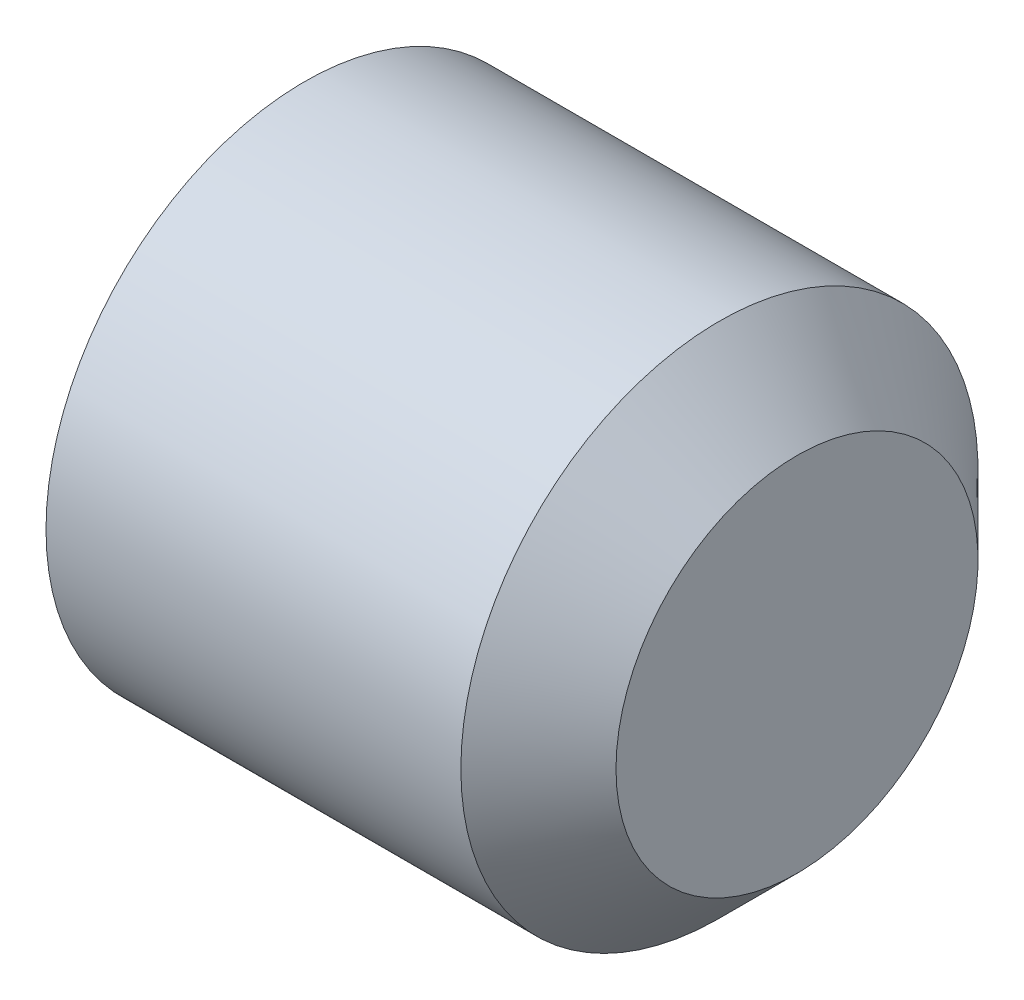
SolidWorks part; units mm, degrees
ref_plane "Plane1" through (0, 0, 0) normal (0, 0, 1) x (1, 0, 0)
ref_plane "Plane2" through (0, 0, 0) normal (0, 1, 0) x (1, 0, 0)
ref_plane "Plane3" through (0, 0, 0) normal (1, 0, 0) x (0, 0, -1)
revolve "BaseBody" add sketch "BodySke" angle 360 about L5
sketch "BodySke" plane through (0, 0, 0) normal (0, 0, 1) x (1, 0, 0)
  line L0 (0, 0) -> (0, 4.172)
  line L1 (0, 4.172) -> (0.478, 5)
  line L2 (0.478, 5) -> (8.5, 5)
  line L3 (8.5, 5) -> (10, 3.5)
  line L4 (10, 0) -> (0, 0)
  line L5 (-12.7, 0) -> (88.9, 0) construction
  line L6 (10, 3.5) -> (10, 0)
  line L7 (10, 3.5) -> (10, 13.025) construction
  line L8 (0, -4.172) -> (0.478, -5) construction
  line L9 (1.5, 15.875) -> (1.5, -3.175) construction
  line L10 (8.5, -5) -> (10, -3.5) construction
  dimension "Length" = 10
  dimension "Diameter" = 10
  dimension "Drive_ch_ang" = 60
  dimension "Minor_dia" = 8.344
  dimension "Cup_nose_ang" = 45
  dimension "Cup_dia" = 7
  dimension "Advance" = 1.5
sketch "Sketch2" plane through (0, 0, 0) normal (-1, 0, 0) x (0, 0, 1)
  line L0 (1.4434, 2.5) -> (-1.4434, 2.5)
  line L1 (-1.4434, 2.5) -> (-2.8868, 0)
  line L2 (1.4434, 2.5) -> (2.8868, 0)
  line L3 (1.4434, -2.5) -> (2.8868, 0)
  line L4 (1.4434, -2.5) -> (-1.4434, -2.5)
  line L5 (-1.4434, -2.5) -> (-2.8868, 0)
  dimension "Hex_size" = 5
  dimension "D2" = 2.5
  dimension "D3" = 2.5
extrude "Hex" cut sketch "Sketch2" against normal blind 5
sketch "Sketch4" plane through (0, 4.7709, -0.5249) normal (-1, 0, 0) x (0, 0, 1)
  line L0 (0.5249, -4.7709) -> (3.3314, -4.7709)
  line L1 (0.5249, -4.7709) -> (6.6732, -1.2211) construction
  line L2 (0.5249, -4.7709) -> (1.9281, -2.3404)
  line L3 (2.8584, -4.1568) -> (3.2099, -3.9539)
  line L4 (2.2234, -3.057) -> (2.5749, -2.8541)
  arc A0 (2.8584, -4.1568) -> (2.2234, -3.057) centre (0.5249, -4.7709) ccw
  arc A1 (3.3314, -4.7709) -> (3.2099, -3.9539) centre (0.5249, -4.7709) ccw
  arc A2 (1.9281, -2.3404) -> (2.5749, -2.8541) centre (0.5249, -4.7709) cw
  circle A3 centre (0.5249, -4.7709) radius 2.413 construction
  circle A4 centre (0.5249, -4.7709) radius 2.8065 construction
  dimension "D1" = 30
  dimension "Spline_n_dim" = 4.826
  dimension "Spline_m_dim" = 5.613
  dimension "Spline_a_dim" = 60
  dimension "D3" = 0.635
  dimension "Spline_p_dim" = 1.27
extrude "Spline6" cut sketch "Sketch4" against normal blind 5
pattern_circular "CirPattern1" count 6 every 60 about axis through (-12.7, 0, 0) along (1, 0, 0)
sketch "Sketch5" plane through (0, 0.6556, 6.6316) normal (-1, 0, 0) x (0, 0, 1)
  line L0 (-6.6316, -0.6556) -> (-3.8251, -0.6556)
  line L1 (-6.6316, -0.6556) -> (-1.6115, 4.3645) construction
  line L2 (-6.6316, -0.6556) -> (-6.6316, 2.1509)
  line L3 (-4.4764, 0.6017) -> (-4.2496, 0.8284)
  line L4 (-5.3744, 1.4997) -> (-5.1476, 1.7265)
  line L5 (-5.3744, 1.4997) -> (-4.4764, 0.6017)
  arc A1 (-3.8251, -0.6556) -> (-4.2496, 0.8284) centre (-6.6316, -0.6556) ccw
  arc A2 (-6.6316, 2.1509) -> (-5.1476, 1.7265) centre (-6.6316, -0.6556) cw
  circle A3 centre (-6.6316, -0.6556) radius 2.413 construction
  circle A4 centre (-6.6316, -0.6556) radius 2.8065 construction
  dimension "D1" = 45
  dimension "Spline_n_dim" = 4.826
  dimension "Spline_m_dim" = 5.613
  dimension "Spline_a_dim" = 90
  dimension "D3" = 0.635
  dimension "Spline_p_dim" = 1.27
extrude "Spline4" cut sketch "Sketch5" against normal blind 5
pattern_circular "CirPattern2" count 4 every 90 about axis through (-12.7, 0, 0) along (1, 0, 0)
sketch "ThdSchSke" plane through (0, 0, 0) normal (0, 0, 1) x (1, 0, 0)
  line L0 (0.478, -4.172) -> (-0.1017, -5)
  line L1 (0.478, -4.172) -> (1.0578, -5)
  line L2 (1.0578, -5) -> (1.0578, -6.25)
  line L3 (-3.175, 0) -> (5.1513, 0) construction
  line L4 (0.478, 5) -> (0.478, -5) construction
  line L5 (1.0578, -6.25) -> (-0.1017, -6.25)
  line L6 (-0.1017, -6.25) -> (-0.1017, -5)
  dimension "Thread_minor" = 8.344
  dimension "Diameter" = 10
  dimension "SideAngle" = 55
  dimension "VeeAngle" = 70
  dimension "Overcut" = 12.5
revolve "ThreadSchematic" cut sketch "ThdSchSke" angle 360 about L3
pattern_linear "ThdSchPat"
equation "\"D2@Sketch2\" = \"Hex_size@Sketch2\" / 2"
equation "\"D3@Sketch2\" = \"Hex_size@Sketch2\" / 2"
equation "\"Thread_minor@ThreadCosmetic\" = \"Minor_dia@BodySke\""
equation "\"D1@Sketch4\" = \"Spline_a_dim@Sketch4\" / 2"
equation "\"D3@Sketch4\" = \"Spline_p_dim@Sketch4\" / 2"
equation "\"D2@CirPattern1\" = \"Spline_a_dim@Sketch4\""
equation "\"Num_teeth@CirPattern1\" = 360 / \"D2@CirPattern1\""
equation "\"Spline_a_dim@Sketch5\" = 90"
equation "\"Spline_p_dim@Sketch5\" = \"Spline_p_dim@Sketch4\""
equation "\"Spline_m_dim@Sketch5\" = \"Spline_m_dim@Sketch4\""
equation "\"Spline_n_dim@Sketch5\" = \"Spline_n_dim@Sketch4\""
equation "\"D1@Sketch5\" = \"Spline_a_dim@Sketch5\" / 2"
equation "\"D3@Sketch5\" = \"Spline_p_dim@Sketch5\" / 2"
equation "\"Key_eng@Spline4\" = \"Key_eng@Spline6\""
equation "\"Thread_minor@ThdSchSke\" = \"Thread_minor@ThreadCosmetic\""
equation "\"Diameter@ThdSchSke\" = \"Diameter@BodySke\""
equation "\"Overcut@ThdSchSke\" = \"Diameter@BodySke\" * 1.25"
equation "\"Num_threads@ThdSchPat\" = int( (\"Length@BodySke\" - ( ( ( \"Diameter@BodySke\" - \"Minor_dia@BodySke\" ) * 0.5 ) / tan( \"Drive_ch_ang@BodySke\" * 0.017453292 ) ) - ( ( ( \"Diameter@BodySke\" - \"Cup_dia@BodySk"
equation "\"Advance@ThdSchPat\" = (\"Length@BodySke\" - ( ( ( \"Diameter@BodySke\" - \"Minor_dia@BodySke\" ) * 0.5 ) / tan( \"Drive_ch_ang@BodySke\" * 0.017453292 ) ) - ( ( ( \"Diameter@BodySke\" - \"Cup_dia@BodySke\" ) * 0."
equation "' \"Num_threads@ThdSchPat\" = \"Num_threads@ThdSchPat\" - sgn( \"Num_threads@ThdSchPat\" - 1) '---chamfered tips only---"
